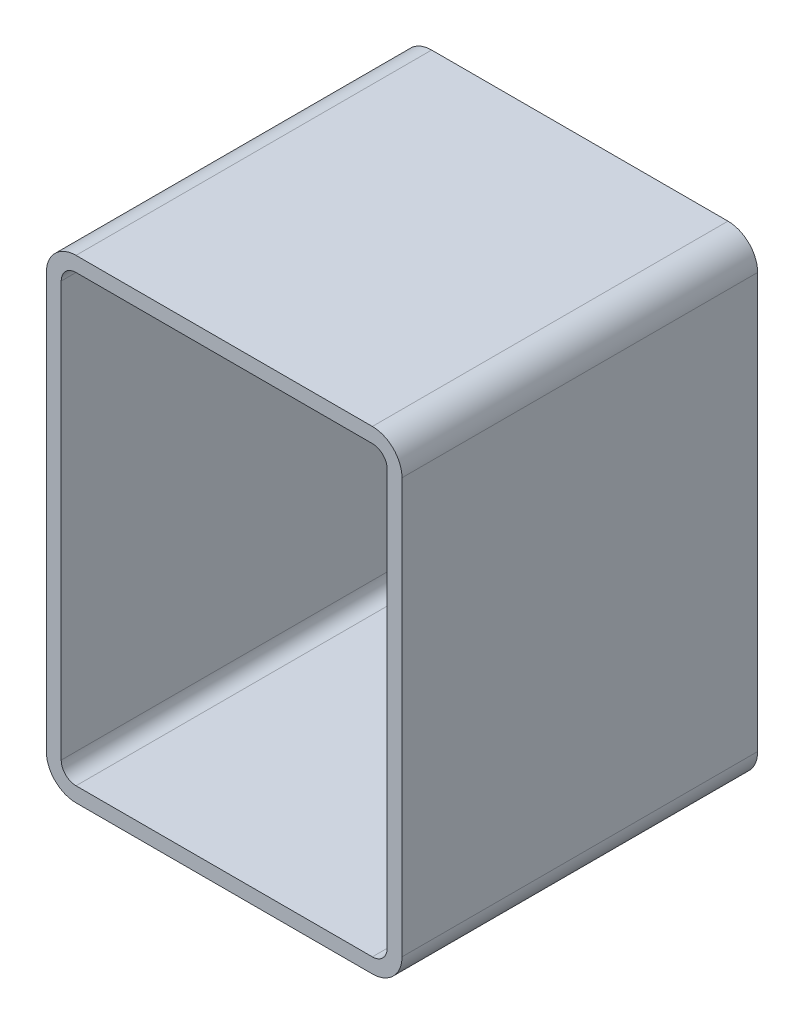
SolidWorks part; units mm, degrees
ref_plane "Front Plane" through (0, 0, 0) normal (0, 0, 1) x (1, 0, 0)
ref_plane "Top Plane" through (0, 0, 0) normal (0, 1, 0) x (1, 0, 0)
ref_plane "Right Plane" through (0, 0, 0) normal (1, 0, 0) x (0, 0, -1)
sketch "Sketch1" plane through (0, 0, 0) normal (0, 0, 1) x (1, 0, 0)
sketch_block_instance "HSS16x12x0.500-1"
sketch_block "HSS16x12x0.500"
extrude "Boss-Extrude1" add sketch "Sketch1" along normal blind 304.8
